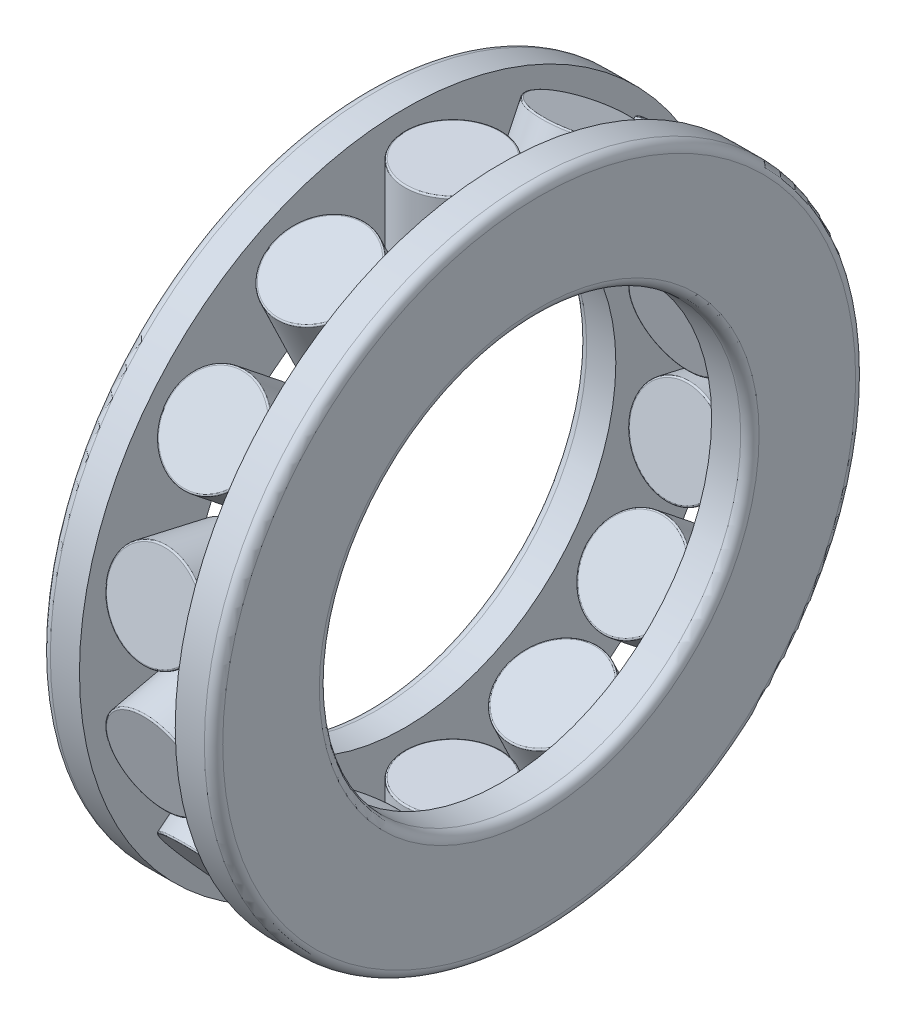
SolidWorks part; units mm, degrees
ref_plane "Plane1" through (0, 0, 0) normal (0, 0, 1) x (1, 0, 0)
ref_plane "Plane2" through (0, 0, 0) normal (0, 1, 0) x (1, 0, 0)
ref_plane "Plane3" through (0, 0, 0) normal (1, 0, 0) x (0, 0, -1)
other "Configuration Table"
sketch "Clipboard" plane through (0, 0, 0) normal (0, 0, 1) x (1, 0, 0)
  line L0 (-10, 0) -> (10, 0) construction
  line L1 (0, 0) -> (21.6965, -5.4095)
  line L2 (0, 0) -> (27.3662, 35.0271)
  line L3 (0, 0) -> (13.7666, -17.6205)
  line L4 (0, 0) -> (-22.3471, -0.7804)
sketch "InnRacSke" plane through (0, 0, 0) normal (0, 0, 1) x (1, 0, 0)
  line L1 (-7.9375, 34.925) -> (-12.7635, 34.925)
  line L2 (-14.2875, 36.449) -> (-14.2875, 52.451)
  line L3 (-12.7635, 53.975) -> (-7.9375, 53.975)
  line L4 (-7.9375, 53.975) -> (-7.9375, 34.925)
  line L5 (-34.925, 0) -> (34.925, 0) construction
  line L6 (0, 0) -> (0, 25.4) construction
  arc A0 (-12.7635, 34.925) -> (-14.2875, 36.449) centre (-12.7635, 36.449) cw
  arc A1 (-14.2875, 52.451) -> (-12.7635, 53.975) centre (-12.7635, 52.451) cw
revolve "Race" add sketch "InnRacSke" angle 360 about L5
ref_axis "Axis1" through (-50, 0, 0) along (1, 0, 0)
sketch "RolDetSke" plane through (0, 0, 0) normal (0, 0, 1) x (1, 0, 0)
  line L0 (0, 33.02) -> (0, 55.88) construction
  line L3 (0, 50.8) -> (7.7232, 50.8)
  line L4 (0, 50.8) -> (0, 38.1)
  line L5 (0, 38.1) -> (7.7232, 38.1)
  line L6 (7.9772, 50.546) -> (7.9772, 38.354)
  arc A0 (7.9772, 38.354) -> (7.7232, 38.1) centre (7.7232, 38.354) cw
  arc A1 (7.7232, 50.8) -> (7.9772, 50.546) centre (7.7232, 50.546) cw
revolve "RollerDetailed" add sketch "RolDetSke" angle 360 about L0
sketch "RolSimSke" plane through (0, 0, 0) normal (0, 0, 1) x (1, 0, 0)
  line L1 (-17.78, 0) -> (12.7, 0) construction
  line L3 (-7.7232, 50.8) -> (7.7232, 50.8)
  line L4 (-7.9772, 50.546) -> (-7.9772, 38.354)
  line L5 (-7.7232, 38.1) -> (7.7232, 38.1)
  line L6 (7.9772, 50.546) -> (7.9772, 38.354)
  arc A0 (-7.9772, 38.354) -> (-7.7232, 38.1) centre (-7.7232, 38.354) ccw
  arc A1 (-7.7232, 50.8) -> (-7.9772, 50.546) centre (-7.7232, 50.546) ccw
  arc A2 (7.9772, 50.546) -> (7.7232, 50.8) centre (7.7232, 50.546) ccw
  arc A3 (7.7232, 38.1) -> (7.9772, 38.354) centre (7.7232, 38.354) ccw
revolve "RollersSimplified" [suppressed] add sketch "RolSimSke" angle 360 about L1
mirror "Mirror1" about plane through (0, 0, 0) normal (1, 0, 0) of "Race"
pattern_circular "RollersDetailed" count 14 every 25.714 about axis through (-50, 0, 0) along (1, 0, 0) of "RollerDetailed"
sketch "CagSpiSke" plane through (0, 0, 0) normal (0, 0, 1) x (1, 0, 0)
  line L0 (1.9943, 35.2743) -> (1.9943, 53.4352)
  line L1 (1.9943, 53.4352) -> (-1.9943, 53.4352)
  line L3 (-1.9943, 35.2743) -> (1.9943, 35.2743)
  line L4 (-34.925, 0) -> (34.925, 0) construction
  line L5 (0, 0) -> (0, 60.773) construction
  line L6 (-1.9943, 35.2743) -> (-1.9943, 53.4352)
revolve "CageSpine" [suppressed] add sketch "CagSpiSke" angle 360 about L4
equation "\"BallCLRad@Clipboard\" =  ( \"OD@InnRacSke\" + \"ID@InnRacSke\" )  / 4"
equation "\"Cyl_Len@RolSimSke\" =  \"Cyl_Len@RolDetSke\""
equation "\"offset@RolSimSke\" =  \"BallCLRad@Clipboard\" - \"Cyl_Len@RolSimSke\" / 2"
equation "\"offset@RolDetSke\" =  \"BallCLRad@Clipboard\" - \"Cyl_Len@RolDetSke\" / 2"
equation "\"Roller_diameter@RolDetSke\" =  \"gap@InnRacSke\" * 1.005"
equation "\"Roller_diameter@RolSimSke\" =  \"gap@InnRacSke\" * 1.005"
equation "\"Max_countClipboard_v1\" =  int( 3.14159265 / atn(( \"Roller_diameter@RolDetSke\" / 2) / sqr( \"offset@RolDetSke\"  *  \"offset@RolDetSke\" - ( \"Roller_diameter@RolDetSke\" / 2) *  ( \"Roller_diameter@RolDetSk"
equation "\"Max_count@Clipboard\" =  ((sgn( \"Max_countClipboard_v1\" - \"Count@Clipboard\" )-1)*( \"Max_countClipboard_v1\" - \"Count@Clipboard\" ))/-2+ \"Count@Clipboard\""
equation "\"CountRollersDetailed_v1\" =  int( \"Show_count@Clipboard\" )"
equation "\"CountRollersDetailed_v2\" =  ((sgn( \"CountRollersDetailed_v1\" - \"Max_count@Clipboard\" )-1)*( \"CountRollersDetailed_v1\" - \"Max_count@Clipboard\" ))/-2+ \"Max_count@Clipboard\""
equation "\"Count@RollersDetailed\" =  ((sgn( \"CountRollersDetailed_v2\" - \"Min_count@Clipboard\" )+1)*( \"CountRollersDetailed_v2\" - \"Min_count@Clipboard\"))/2 +\"Min_count@Clipboard\""
equation "\"Angle@RollersDetailed\" =  360.0 / \"Max_count@Clipboard\""
equation "\"AngleCageSpine_v1\" =  \"Angle@RollersDetailed\" * ( \"Count@RollersDetailed\" -1 + int( \"Count@RollersDetailed\" / \"Max_count@Clipboard\" ) )  + 0.001 -  int( \"Count@RollersDetailed\" / \"Max_count@Clipboard"
equation "\"Angle@CageSpine\" =  \"AngleCageSpine_v1\" * int( \"Min_count@Clipboard\" / 2) + int(1 / \"Min_count@Clipboard\")  * 0.001"
equation "\"Thickness@CagSpiSke\" =  \"Roller_diameter@RolDetSke\" * 0.25"
equation "\"OD@CagSpiSke\" =  \"OD@InnRacSke\" * 0.99"
equation "\"ID@CagSpiSke\" =  \"ID@InnRacSke\" * 1.01"
equation "\"Halfdia@RolSimSke\" =  \"Roller_diameter@RolSimSke\" / 2"
